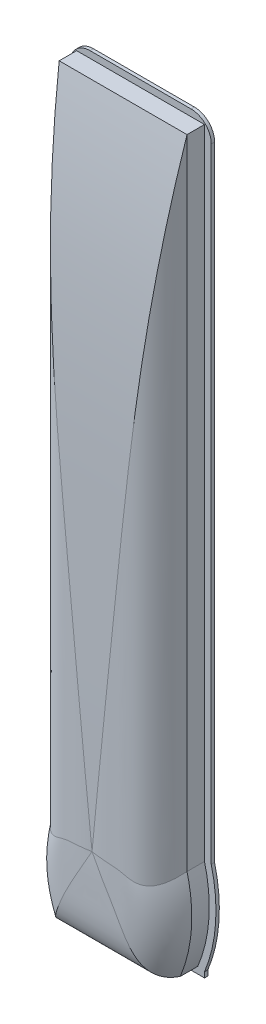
SolidWorks part; units mm, degrees
ref_plane "Ebene vorne" through (0, 0, 0) normal (0, 0, 1) x (1, 0, 0)
ref_plane "Ebene oben" through (0, 0, 0) normal (0, 1, 0) x (1, 0, 0)
ref_plane "Ebene rechts" through (0, 0, 0) normal (1, 0, 0) x (0, 0, -1)
sketch "Oben Master" plane through (0, 0, 0) normal (0, 0, 1) x (1, 0, 0)
  line L0 (0, 0) -> (0, 113.819) construction
  line L1 (7.4998, 109.3467) -> (-7.4998, 109.3467)
  line L2 (-9.5, 107.3446) -> (-9.5, 14.4995)
  line L3 (-8.5, 0.4995) -> (-8.5, 0.4995)
  line L4 (-8.5, 0.4995) -> (-3.5, 0.4995)
  line L5 (-3.5, 0.4995) -> (-3.5, 1)
  line L6 (-3.5, 1) -> (3.5, 1)
  line L7 (3.5, 1) -> (3.5, 0.4995)
  line L8 (3.5, 0.4995) -> (8.5, 0.4995)
  line L9 (8.5, 0.4995) -> (8.5, 0.4995)
  line L10 (9.5, 14.4995) -> (9.5, 107.3446)
  line L20 (2.5, 0) -> (2.5, -0.5005)
  line L21 (2.5, -0.5005) -> (9.5, -0.5005)
  line L22 (9.5, -0.5005) -> (9.5, 0.3012)
  line L23 (10.5, 14.6254) -> (10.5, 107.3448)
  line L24 (7.5, 110.3467) -> (-7.5, 110.3467)
  line L25 (-10.5, 107.3448) -> (-10.5, 14.6254)
  line L26 (-9.5, 0.3012) -> (-9.5, -0.5005)
  line L27 (-9.5, -0.5005) -> (-2.5, -0.5005)
  line L28 (-2.5, -0.5005) -> (-2.5, 0)
  line L29 (-2.5, 0) -> (2.5, 0)
  arc A0 (-9.5, 14.4995) -> (-8.5, 0.4995) centre (11.7977, 8.9851) ccw
  arc A1 (8.5, 0.4995) -> (9.5, 14.4995) centre (-11.7977, 8.9851) ccw
  arc A4 (9.5, 0.3012) -> (10.5, 14.6254) centre (-11.7977, 8.9851) ccw
  arc A5 (-10.5, 14.6254) -> (-9.5, 0.3012) centre (11.7977, 8.9851) ccw
  ellipse E1 centre (-9.5, 104.4132) end of major axis (-9.5, 105.4141) minor radius 1 (-10.5, 104.4132) -> (-9.5, 103.4122) ccw
  ellipse E3 centre (-9.5, 104.4132) end of major axis (-9.5, 105.4141) minor radius 1 (-9.5, 105.4141) -> (-10.5, 104.4132) ccw
  ellipse E5 centre (-9.5, 95.3481) end of major axis (-9.5, 96.3491) minor radius 1 (-9.5, 96.3491) -> (-10.5, 95.3481) ccw
  ellipse E7 centre (-9.5, 95.3481) end of major axis (-9.5, 96.3491) minor radius 1 (-10.5, 95.3481) -> (-9.5, 94.3471) ccw
  ellipse E9 centre (-9.5, 88.4775) end of major axis (-9.5, 87.4765) minor radius 1 (-9.5, 89.4785) -> (-10.5, 88.4775) ccw
  ellipse E11 centre (-9.5, 88.4775) end of major axis (-9.5, 87.4765) minor radius 1 (-10.5, 88.4775) -> (-9.5, 87.4765) ccw
  ellipse E13 centre (-9.5, 79.4124) end of major axis (-9.5, 78.4114) minor radius 1 (-9.5, 80.4134) -> (-10.5, 79.4124) ccw
  ellipse E15 centre (-9.5, 79.4124) end of major axis (-9.5, 80.4134) minor radius 1 (-10.5, 79.4124) -> (-9.5, 78.4114) ccw
  ellipse E17 centre (-9.5, 72.5418) end of major axis (-9.5, 71.5408) minor radius 1 (-9.5, 73.5428) -> (-10.5, 72.5418) ccw
  ellipse E19 centre (-9.5, 72.5418) end of major axis (-9.5, 71.5408) minor radius 1 (-10.5, 72.5418) -> (-9.5, 71.5408) ccw
  ellipse E21 centre (-9.5, 63.4767) end of major axis (-9.5, 62.4758) minor radius 1 (-9.5, 64.4777) -> (-10.5, 63.4767) ccw
  ellipse E23 centre (-9.5, 63.4767) end of major axis (-9.5, 64.4777) minor radius 1 (-10.5, 63.4767) -> (-9.5, 62.4758) ccw
  ellipse E25 centre (-9.5, 56.6061) end of major axis (-9.5, 55.6051) minor radius 1 (-9.5, 57.6071) -> (-10.5, 56.6061) ccw
  ellipse E27 centre (-9.5, 56.6061) end of major axis (-9.5, 57.6071) minor radius 1 (-10.5, 56.6061) -> (-9.5, 55.6051) ccw
  ellipse E29 centre (-9.5, 47.5411) end of major axis (-9.5, 46.5401) minor radius 1 (-9.5, 48.542) -> (-10.5, 47.5411) ccw
  ellipse E31 centre (-9.5, 47.5411) end of major axis (-9.5, 48.542) minor radius 1 (-10.5, 47.5411) -> (-9.5, 46.5401) ccw
  ellipse E33 centre (-9.5, 40.6705) end of major axis (-9.5, 39.6695) minor radius 1 (-9.5, 41.6714) -> (-10.5, 40.6705) ccw
  ellipse E35 centre (-9.5, 40.6705) end of major axis (-9.5, 39.6695) minor radius 1 (-10.5, 40.6705) -> (-9.5, 39.6695) ccw
  ellipse E37 centre (-9.5, 31.6054) end of major axis (-9.5, 32.6064) minor radius 1 (-10.5, 31.6054) -> (-9.5, 30.6044) ccw
  ellipse E39 centre (-9.5, 31.6054) end of major axis (-9.5, 30.6044) minor radius 1 (-9.5, 32.6064) -> (-10.5, 31.6054) ccw
  ellipse E41 centre (-9.5, 24.7348) end of major axis (-9.5, 25.7358) minor radius 1 (-9.5, 25.7358) -> (-10.5, 24.7348) ccw
  ellipse E43 centre (-9.5, 24.7348) end of major axis (-9.5, 25.7358) minor radius 1 (-10.5, 24.7348) -> (-9.5, 23.7338) ccw
  ellipse E45 centre (-9.5, 15.6697) end of major axis (-9.5, 16.6707) minor radius 1 (-9.5, 16.6707) -> (-10.5, 15.6697) ccw
  ellipse E47 centre (-9.5, 15.6697) end of major axis (-9.5, 16.6707) minor radius 1 (-10.5, 15.6697) -> (-9.5, 14.6687) ccw
  ellipse E49 centre (-10.1882, 9.8177) end of major axis (-10.1882, 10.8187) minor radius 1 (-10.1295, 10.817) -> (-11.1875, 9.8537) ccw
  ellipse E51 centre (-10.1882, 9.8177) end of major axis (-9.1882, 9.8177) minor radius 0.999 (-11.1882, 9.8177) -> (-10.2013, 8.8188) ccw
  ellipse E53 centre (-9.7425, 4.5537) end of major axis (-9.7425, 3.5528) minor radius 1 (-9.9237, 5.5382) -> (-10.7425, 4.5537) ccw
  ellipse E55 centre (-9.7425, 4.5537) end of major axis (-8.7425, 4.5537) minor radius 0.999 (-10.7425, 4.5537) -> (-9.5167, 3.5805) ccw
  ellipse E57 centre (-5.6, 109.39) end of major axis (-5.6, 108.3891) minor radius 1 (-5.6443, 110.39) -> (-6.6, 109.39) ccw
  ellipse E59 centre (-5.6, 109.39) end of major axis (-5.6, 108.3891) minor radius 1 (-4.6, 109.39) -> (-5.5557, 110.39) ccw
  ellipse E61 centre (0, 109.39) end of major axis (0, 108.3891) minor radius 1 (-0.0443, 110.39) -> (-1, 109.39) ccw
  ellipse E63 centre (0, 109.39) end of major axis (0, 108.3891) minor radius 1 (1, 109.39) -> (0.0443, 110.39) ccw
  ellipse E65 centre (5.6, 109.39) end of major axis (5.6, 110.391) minor radius 1 (6.6, 109.39) -> (5.6443, 110.39) ccw
  ellipse E67 centre (5.6, 109.39) end of major axis (5.6, 110.391) minor radius 1 (5.5557, 110.39) -> (4.6, 109.39) ccw
  spline S0 degree 1 poles (-7.4998, 109.3467) (-9.5, 107.3446) knots 0 0 1 1 construction
  spline S1 degree 1 poles (9.5, 107.3446) (7.4998, 109.3467) knots 0 0 1 1 construction
  spline S2 degree 3 poles (-7.4998, 109.3467) (-8.01, 109.3465) (-9.0728, 108.9205) (-9.4998, 107.8555) (-9.5, 107.3446) knots 0.00005 0.00005 0.00005 0.00005 0.5 0.999949 0.999949 0.999949 0.999949
  spline S3 degree 3 poles (9.5, 107.3446) (9.4998, 107.8551) (9.0741, 108.9192) (8.0103, 109.3465) (7.4998, 109.3467) knots 0.00005 0.00005 0.00005 0.00005 0.499999 0.999949 0.999949 0.999949 0.999949
  spline S5 degree 2 poles (10.5, 107.3448) (10.4998, 107.9419) (10.2718, 108.4932) (10.044, 109.0439) (9.6224, 109.4664) (9.2017, 109.888) (8.6508, 110.1171) (8.0991, 110.3465) (7.5, 110.3467) knots 0 0 0 0.25 0.25 0.5 0.5 0.75 0.75 1 1 1
  spline S6 degree 2 poles (-7.5, 110.3467) (-8.0971, 110.3465) (-8.6484, 110.1181) (-9.1987, 109.89) (-9.6209, 109.4679) (-10.042, 109.0468) (-10.2708, 108.4957) (-10.4998, 107.9439) (-10.5, 107.3448) knots 0 0 0 0.25 0.25 0.5 0.5 0.75 0.75 1 1 1
  dimension "D1" = 1
ref_plane "Hinten" through (0, 110.3467, 0) normal (0, 1, 0) x (-1, 0, 0)
ref_plane "Vorn" through (0, -0.5005, 0) normal (0, 1, 0) x (-1, 0, 0)
ref_plane "Ebene3" through (0, 109.3467, 0) normal (0, 1, 0) x (-1, 0, 0)
sketch "Hinten eckig" plane through (0, 110.3467, 0) normal (0, 1, 0) x (-1, 0, 0)
  line B0 (3.9658, 9.3399) -> (4.2597, 9.5705)
  line B1 (4.1712, 9.1409) -> (3.9658, 9.3399)
  line B2 (-0.8535, 3.2331) -> (-0.835, 0.4969)
  line B3 (0.7828, 0.5219) -> (0.7642, 3.2582)
  line B4 (0.7951, -1.8098) -> (0.7828, 0.5219)
  line B5 (5.9708, 0.4833) -> (5.9523, 3.2195)
  line B6 (4.3878, 0.5182) -> (0.7828, 0.5219)
  line B7 (0.7795, -0.0373) -> (4.3846, -0.0409)
  line B8 (-0.835, 0.4969) -> (-4.44, 0.5006)
  line B9 (-4.4086, 0.0014) -> (-0.8034, -0.0023)
  line B10 (-3.9584, 9.3601) -> (-4.2239, 9.5939)
  line B11 (-9.3309, 1.3292) -> (-9.3343, 0.7699)
  line B12 (-4.1575, 9.1548) -> (-3.9584, 9.3601)
  line B13 (-6.023, 0.5356) -> (-8.0452, 0.5043)
  line B14 (0.0262, 12.5033) -> (-1.2819, 12.4592)
  line B15 (-1.2819, 12.4592) -> (-2.6595, 12.2951)
  line B16 (4.0007, 9.3998) -> (3.691, 9.419)
  line B17 (0.149, 9.9471) -> (-0.1006, 9.9314)
  line B18 (-1.753, 9.8463) -> (-2.0974, 9.8053)
  line B19 (-3.6741, 9.4359) -> (-3.9584, 9.3601)
  line B20 (-8.9516, 2.9531) -> (-9.1696, 2.4381)
  line B21 (-9.1696, 2.4381) -> (-9.2676, 1.8537)
  line B22 (-9.0369, 3.0826) -> (-9.255, 2.5678)
  line B23 (-9.255, 2.5678) -> (-9.413, 2.0179)
  line B24 (-8.7523, 4.6814) -> (-9.3085, 3.721)
  line B25 (-8.7933, 5.0258) -> (-9.3148, 4.1254)
  line B26 (-8.7395, 5.3955) -> (-9.2958, 4.435)
  line B27 (10.7962, 4.6627) -> (11.1754, 4.7637)
  line B28 (-10.4073, 0) -> (10.4073, 0)
sketch_block_instance "Block4-1"
sketch_block "Block4"
sketch "Vorn rund" plane through (0, -0.5005, 0) normal (0, 1, 0) x (-1, 0, 0)
  line L0 (2.5, 0) -> (-2.5, 0) construction
  line L1 (2.5, 0) -> (-2.5, 0)
  line L2 (0, 0) -> (0, -4.3632) construction
  line B0 (-11.3923, 1.0416) -> (-11.3496, 0.1382)
  line B1 (-10.6355, 0.1293) -> (-10.6008, 0.7487)
  line B2 (8.4284, -5.6606) -> (-8.4783, -5.7396)
  line B3 (-3.0393, -2.3777) -> (-3.0296, 0.0141)
  line B4 (7.4782, 5.6712) -> (5.4825, 6.6529)
  line B5 (5.4825, 6.6529) -> (4.476, 6.9889)
  line B6 (1.0949, 7.6442) -> (-0.0494, 7.7393)
  line B7 (-0.0494, 7.7393) -> (-1.297, 7.6537)
  line B8 (-1.297, 7.6537) -> (-2.6737, 7.4823)
  line B9 (-7.8197, 5.4712) -> (-8.405, 5.0068)
  line B10 (-8.405, 5.0068) -> (-8.8956, 4.5682)
  line B11 (-9.4207, 4.0694) -> (-9.7909, 3.5619)
  line B12 (-7.0407, -3.9247) -> (-6.3008, -4.0283)
  line B13 (-6.3008, -4.0283) -> (-5.8878, -3.865)
  line B14 (-6.5833, -0.7501) -> (-7.0566, -0.8789)
  line B15 (-10.9797, 0.0864) -> (-11.0744, 0.0606)
  line B16 (-11.0744, 0.0606) -> (-11.1345, 0.095)
  line B17 (-11.1345, 0.095) -> (-11.2292, 0.0693)
  line B18 (-11.2292, 0.0693) -> (-11.3496, 0.1382)
  line B19 (-9.9645, -0.0947) -> (-10.6529, -0.1805)
  line B20 (-10.9626, -0.1631) -> (-11.3154, -0.3608)
sketch_block_instance "Block5-1"
sketch_block "Block5"
sketch "Skizze7" plane through (0, 0, 0) normal (0, 0, 1) x (1, 0, 0)
  line L0 (11.7977, 8.9851) -> (-11.7977, 8.9851) construction
  line L10 (-2.5, -0.5005) -> (-2.5, 0)
  line L11 (-9.5, -0.5005) -> (-2.5, -0.5005)
  line L12 (-9.5, 0.3012) -> (-9.5, -0.5005)
  line L13 (-10.5, 107.3448) -> (-10.5, 14.6254)
  line L14 (7.5, 110.3467) -> (-7.5, 110.3467)
  line L15 (10.5, 14.6254) -> (10.5, 107.3448)
  line L16 (9.5, -0.5005) -> (9.5, 0.3012)
  line L17 (2.5, -0.5005) -> (9.5, -0.5005)
  line L18 (2.5, 0) -> (2.5, -0.5005)
  line L19 (-2.5, 0) -> (2.5, 0)
  line L20 (-2.5, -0.5005) -> (-2.5, 0)
  line L21 (-9.5, -0.5005) -> (-2.5, -0.5005)
  line L22 (-9.5, 0.3012) -> (-9.5, -0.5005)
  line L23 (-10.5, 107.3448) -> (-10.5, 14.6254)
  line L24 (7.5, 110.3467) -> (-7.5, 110.3467)
  line L25 (10.5, 14.6254) -> (10.5, 107.3448)
  line L26 (9.5, -0.5005) -> (9.5, 0.3012)
  line L27 (2.5, -0.5005) -> (9.5, -0.5005)
  line L28 (2.5, 0) -> (2.5, -0.5005)
  line L29 (-2.5, 0) -> (2.5, 0)
  arc A2 (-10.5, 14.6254) -> (-9.5, 0.3012) centre (11.7977, 8.9851) ccw
  arc A3 (9.5, 0.3012) -> (10.5, 14.6254) centre (-11.7977, 8.9851) ccw
  arc A4 (-10.5, 14.6254) -> (-9.5, 0.3012) centre (11.7977, 8.9851) ccw
  arc A5 (9.5, 0.3012) -> (10.5, 14.6254) centre (-11.7977, 8.9851) ccw
  spline S2 degree 2 poles (713.2699, -2800.8964) (54.1611, 136.1464) (-8.6484, 110.1181) (-9.1987, 109.89) (-9.6209, 109.4679) (-10.042, 109.0468) (-10.2708, 108.4957) (-36.3165, 45.7429) (2896.8308, -629.2597) knots -28.236731 -28.236731 -28.236731 0.25 0.25 0.5 0.5 0.75 0.75 29.181014 29.181014 29.181014 only from (-7.5, 110.3467) to (-10.5, 107.3448)
  spline S3 degree 2 poles (-2900.6155, -613.9447) (36.2756, 45.6192) (10.2718, 108.4932) (10.044, 109.0439) (9.6224, 109.4664) (9.2017, 109.888) (8.6508, 110.1171) (-54.0371, 136.1872) (-728.5512, -2797.0685) knots -28.261947 -28.261947 -28.261947 0.25 0.25 0.5 0.5 0.75 0.75 29.155742 29.155742 29.155742 only from (10.5, 107.3448) to (7.5, 110.3467)
  spline S4 degree 2 poles (-7.5, 110.3467) (-8.0971, 110.3465) (-8.6484, 110.1181) (-9.1987, 109.89) (-9.6209, 109.4679) (-10.042, 109.0468) (-10.2708, 108.4957) (-10.4998, 107.9439) (-10.5, 107.3448) knots 0 0 0 0.25 0.25 0.5 0.5 0.75 0.75 1 1 1
  spline S5 degree 2 poles (10.5, 107.3448) (10.4998, 107.9419) (10.2718, 108.4932) (10.044, 109.0439) (9.6224, 109.4664) (9.2017, 109.888) (8.6508, 110.1171) (8.0991, 110.3465) (7.5, 110.3467) knots 0 0 0 0.25 0.25 0.5 0.5 0.75 0.75 1 1 1
  dimension "D1" = 0
extrude "Linear austragen1" add sketch "Skizze7" along normal blind 0.5
sketch "Skizze20" plane through (0, 0, 0.5) normal (0, 0, 1) x (1, 0, 0)
  line L20 (-8.5, 0.4995) -> (-3.5, 0.4995)
  line L21 (-3.5, 0.4995) -> (-3.5, 1)
  line L22 (-3.5, 1) -> (3.5, 1)
  line L23 (3.5, 1) -> (3.5, 0.4995)
  line L24 (3.5, 0.4995) -> (8.5, 0.4995)
  line L25 (9.5, 14.4995) -> (9.5, 107.3444)
  line L26 (7.5, 109.3467) -> (-7.4996, 109.3467)
  line L27 (-9.5, 107.3448) -> (-9.5, 14.4995)
  line L28 (-8.5, 0.4995) -> (8.5, 0.4995)
  line L33 (9.5, 14.4995) -> (9.5, 109.3467)
  line L34 (9.5, 109.3467) -> (-9.5, 109.3467)
  line L35 (-9.5, 109.3467) -> (-9.5, 14.4995)
  arc A4 (8.5, 0.4995) -> (9.5, 14.4995) centre (-11.7977, 8.9851) ccw
  arc A5 (-9.5, 14.4995) -> (-8.5, 0.4995) centre (11.7977, 8.9851) ccw
  arc A6 (8.5, 0.4995) -> (9.5, 14.4995) centre (-11.7977, 8.9851) ccw
  arc A7 (-9.5, 14.4995) -> (-8.5, 0.4995) centre (11.7977, 8.9851) ccw
  spline S4 degree 3 poles (3964.4855, 699.077) (-562.275, -46.0003) (14.8299, 80.6068) (9.4371, 107.8617) (9.3983, 107.9884) (9.2983, 108.2308) (9.2375, 108.346) (9.0928, 108.5635) (9.008, 108.6662) (8.8237, 108.8513) (8.7234, 108.9347) (8.5051, 109.0812) (8.3882, 109.1432) (-5.6702, 114.9984) (-93.3907, -37.5243) (3687.0661, -1447.9628) knots -26.430749 -26.430749 -26.430749 -26.430749 0.125 0.125 0.25 0.25 0.375 0.375 0.5 0.5 0.625 0.625 0.75 0.75 15.225421 15.225421 15.225421 15.225421 only from (9.5, 107.3444) to (7.5, 109.3467)
  spline S5 degree 3 poles (-599.4917, 4064.2795) (145.9772, -463.2528) (19.2162, 114.6882) (-8.0169, 109.2836) (-8.1436, 109.2447) (-8.3858, 109.1445) (-8.501, 109.0836) (-8.7183, 108.9385) (-8.8209, 108.8536) (-9.0057, 108.669) (-9.0889, 108.5686) (-9.2352, 108.35) (-9.297, 108.2332) (-15.1452, 94.1505) (137.5454, 6.4943) (1533.7503, 3792.9331) knots -26.411857 -26.411857 -26.411857 -26.411857 0.125 0.125 0.25 0.25 0.375 0.375 0.5 0.5 0.625 0.625 0.75 0.75 15.244525 15.244525 15.244525 15.244525 only from (-7.4996, 109.3467) to (-9.5, 107.3448)
  spline S6 degree 3 poles (9.5, 107.3444) (9.5, 107.4764) (9.4876, 107.6063) (9.4371, 107.8617) (9.3983, 107.9884) (9.2983, 108.2308) (9.2375, 108.346) (9.0928, 108.5635) (9.008, 108.6662) (8.8237, 108.8513) (8.7234, 108.9347) (8.5051, 109.0812) (8.3882, 109.1432) (8.0272, 109.2936) (7.7644, 109.3466) (7.5, 109.3467) knots 0 0 0 0 0.125 0.125 0.25 0.25 0.375 0.375 0.5 0.5 0.625 0.625 0.75 0.75 1 1 1 1 construction
  spline S7 degree 3 poles (-7.4996, 109.3467) (-7.6316, 109.3467) (-7.7615, 109.3343) (-8.0169, 109.2836) (-8.1436, 109.2447) (-8.3858, 109.1445) (-8.501, 109.0836) (-8.7183, 108.9385) (-8.8209, 108.8536) (-9.0057, 108.669) (-9.0889, 108.5686) (-9.2352, 108.35) (-9.297, 108.2332) (-9.447, 107.8719) (-9.4999, 107.6092) (-9.5, 107.3448) knots 0 0 0 0 0.125 0.125 0.25 0.25 0.375 0.375 0.5 0.5 0.625 0.625 0.75 0.75 1 1 1 1 construction
  dimension "D1" = 1
extrude "Linear austragen7" add sketch "Skizze20" along normal blind 2.6
sketch "Skizze6" plane through (0, -0.5005, 0) normal (0, 1, 0) x (-1, 0, 0)
  line L0 (0, -6.8266) -> (0, 9.0288) construction
  line L1 (-0.0494, 7.7393) -> (-7.8197, 5.4712) construction
  line L2 (-3.9345, 6.6052) -> (-0.0138, -6.8266) construction
  line L3 (-2.5892, 1.9964) -> (-2.6957, 2.3611) construction
  line L4 (0.5228, 7.6917) -> (6.7967, 6.0065) construction
  line L5 (1.0949, 7.6442) -> (-0.0494, 7.7393) construction
  line L6 (7.4782, 5.6712) -> (5.4825, 6.6529) construction
  line L7 (3.6597, 6.8491) -> (-0.0138, -6.8266) construction
  line L8 (-1.4467, -8.0426) -> (2.1223, -8.0426) construction
  line L9 (-0.0138, -6.8266) -> (0.0485, -6.8266) construction
  line L10 (-10.6252, 0.3118) -> (-9.7909, 3.5619) construction
  line L11 (-10.6355, 0.1293) -> (-10.6008, 0.7487) construction
  line L12 (-9.7909, 3.5619) -> (-10.208, 1.9368) construction
  line L13 (-10.208, 1.9368) -> (-1.9532, -0.1823) construction
  line L14 (-9.7909, 3.5619) -> (-8.405, 5.0068) construction
  line L15 (-9.0979, 4.2844) -> (-5.3503, 0.6897) construction
  line L16 (-8.4323, 5.0196) -> (0, -6.8266) construction
  line L17 (8.4323, 5.0196) -> (0, -6.8266) construction
  line L18 (0, 0) -> (-13.7892, 0) construction
  line L20 (-9.5, 0.5) -> (-11.2023, 0.5) construction
  line L21 (9.0979, 4.2844) -> (5.3503, 0.6897) construction
  line L22 (10.6617, 0.5) -> (-10.6617, 0.5)
  line L23 (9.7909, 3.5619) -> (8.405, 5.0068) construction
  line L24 (9.7909, 3.5619) -> (10.208, 1.9368) construction
  line L25 (10.6252, 0.3118) -> (9.7909, 3.5619) construction
  arc A0 (8.4323, 5.0196) -> (-8.4323, 5.0196) centre (0, -6.8266) ccw
  arc A1 (-8.4323, 5.0196) -> (-10.6617, 0.5) centre (-5.3503, 0.6897) ccw
  arc A2 (8.4323, 5.0196) -> (10.6617, 0.5) centre (5.3503, 0.6897) cw
sketch "Skizze8" plane through (0, 109.3467, 0) normal (0, 1, 0) x (-1, 0, 0)
  line L0 (-3.965, 9.35) -> (3.965, 9.35) construction
  line L1 (9.5, 0.5) -> (9.5, 2.3569)
  line L2 (0, 0) -> (3.965, 9.35) construction
  line L3 (0, 0) -> (0, 15.3071) construction
  line L4 (0, 0) -> (-3.965, 9.35) construction
  line L5 (-4.543, 8.8909) -> (-9.0199, 3.6569)
  line L6 (-9.5, 0.5) -> (-9.5, 2.3569)
  line L8 (-7.5, 0.5) -> (7.5, 0.5) construction
  line L9 (4.543, 8.8909) -> (9.0199, 3.6569)
  line L10 (-10.5, 0.5) -> (-10.5, 0) construction
  line L11 (10.5, 0.5) -> (10.5, 0) construction
  line L12 (-9.5, 0.5) -> (9.5, 0.5)
  arc A0 (-3.5526, 9.5195) -> (3.5526, 9.5195) centre (0, -3.4217) cw
  arc A1 (-3.5526, 9.5195) -> (-4.543, 8.8909) centre (-3.0232, 7.5909) ccw
  arc A2 (4.543, 8.8909) -> (3.5526, 9.5195) centre (3.0232, 7.5909) ccw
  arc A3 (-9.5, 2.3569) -> (-9.0199, 3.6569) centre (-7.5, 2.3569) cw
  arc A4 (9.5, 2.3569) -> (9.0199, 3.6569) centre (7.5, 2.3569) ccw
  dimension "D3" = 1
  dimension "D1" = 2
  dimension "D2" = 9.35
  dimension "D4" = 1
ref_plane "Ebene1" through (0, 8.9851, 0) normal (0, 1, 0) x (-1, 0, 0)
sketch "Skizze10" plane through (0, 8.9851, 0) normal (0, 1, 0) x (-1, 0, 0)
  line L0 (0, 0) -> (0, 9.7413) construction
  line L1 (-10.6617, 0.5) -> (10.6617, 0.5)
  line L2 (8.5, 3.1) -> (-8.5, 3.1) construction
  line L3 (-11.2023, 0.5) -> (-10.2023, 0.5) construction
  line L4 (-7.5, 0.5) -> (-10.5, 0.5) construction
  line L5 (10.2023, 3.1) -> (-10.2023, 3.1)
  line L6 (-8.5, 3.1) -> (-10.2023, 3.1) construction
  arc A0 (-10.2023, 3.1) -> (-8.673, 4.8446) centre (-5.3844, 0.4192) cw
  arc A1 (10.2023, 3.1) -> (8.673, 4.8446) centre (5.3844, 0.4192) ccw
  arc A3 (10.6617, 0.5) -> (8.4323, 5.0196) centre (5.3503, 0.6897) ccw
  arc A4 (8.4323, 5.0196) -> (-8.4323, 5.0196) centre (0, -6.8266) ccw
  arc A5 (-8.4323, 5.0196) -> (-10.6617, 0.5) centre (-5.3503, 0.6897) ccw
  arc A7 (8.673, 4.8446) -> (-8.673, 4.8446) centre (0, -6.8266) ccw
  dimension "D2" = 1
  dimension "D1" = 0
ref_plane "Ebene2" through (0, 14.6254, 0) normal (0, 1, 0) x (-1, 0, 0)
sketch "Formgeber Mitte" plane through (0, 14.6254, 0) normal (0, 1, 0) x (-1, 0, 0)
  line L0 (0, -6.822) -> (0, 15.3071) construction
  line L1 (-9.5, 3.1) -> (9.5, 3.1) construction
  line L5 (-9.5, 3.1) -> (9.5, 3.1)
  line L10 (0, 0) -> (0, -2.1163) construction
  line L11 (-9.5, 3.1) -> (-7.1707, 5.8233)
  line L12 (-4.543, 8.8909) -> (-9.0199, 3.6569) construction
  line L13 (9.5, 3.1) -> (7.1707, 5.8233)
  arc A5 (8.673, 4.8446) -> (-8.673, 4.8446) centre (0, -6.8266) ccw construction
  arc A6 (7.1707, 5.8233) -> (-7.1707, 5.8233) centre (0, -6.8266) ccw
sketch "Formgeber hinten" plane through (0, 109.3467, 0) normal (0, 1, 0) x (1, 0, 0)
  line L0 (4.543, -8.8909) -> (9.0199, -3.6569) construction
  line L1 (4.543, -8.8909) -> (9.4962, -3.1)
  line L2 (-4.543, -8.8909) -> (-9.0199, -3.6569) construction
  line L3 (-4.543, -8.8909) -> (-9.4962, -3.1)
  line L4 (9.5, -3.1) -> (-9.5, -3.1) construction
  line L5 (9.4962, -3.1) -> (-9.4962, -3.1)
  arc A0 (3.5526, -9.5195) -> (4.543, -8.8909) centre (3.0232, -7.5909) ccw construction
  arc A1 (3.5526, -9.5195) -> (4.543, -8.8909) centre (3.0232, -7.5909) ccw
  arc A2 (-3.5526, -9.5195) -> (3.5526, -9.5195) centre (0, 3.4217) ccw construction
  arc A3 (-3.5526, -9.5195) -> (3.5526, -9.5195) centre (0, 3.4217) ccw
  arc A4 (-4.543, -8.8909) -> (-3.5526, -9.5195) centre (-3.0232, -7.5909) ccw construction
  arc A5 (-4.543, -8.8909) -> (-3.5526, -9.5195) centre (-3.0232, -7.5909) ccw
sketch "Rücken" plane through (0, 0, 0) normal (1, 0, 0) x (0, 0, -1)
  line L0 (-9.5195, 109.3467) -> (-9.9983, 109.3467) construction
  line L1 (-9.5195, 109.3467) -> (-9.9983, 109.3467) construction
  line L3 (-3.1, 0.4995) -> (-0.5, 0.4995) construction
  line L4 (-4.8446, 8.9851) -> (-7.7143, 8.9851) construction
  line L5 (-4.8446, 8.9851) -> (-7.7143, 8.9851) construction
  line L6 (-3.1, 0.4995) -> (-0.5, 0.4995) construction
  line L7 (-7.7143, 8.9851) -> (-9.9983, 109.3467)
  spline S0 degree 3 poles (-7.7143, 8.9851) (-7.6435, 5.8735) (-7.8099, 0.9279) (-3.1, 0.4995) knots 0 0 0 0 1 1 1 1
sketch "Pkt vorn" plane through (0, 14.6254, 0) normal (0, 1, 0) x (-1, 0, 0)
  arc A0 (7.1707, 5.8233) -> (-7.1707, 5.8233) centre (0, -6.8266) ccw construction
  arc A1 (7.1707, 5.8233) -> (-7.1707, 5.8233) centre (0, -6.8266) ccw construction
  point P3 (0, 7.7143)
sketch "Pkt hinten" plane through (0, 109.3467, 0) normal (0, 1, 0) x (-1, 0, 0)
  arc A0 (3.5526, 9.5195) -> (-3.5526, 9.5195) centre (0, -3.4217) ccw construction
  arc A1 (3.5526, 9.5195) -> (-3.5526, 9.5195) centre (0, -3.4217) ccw construction
  point P3 (0, 9.9983)
sketch "Leitlinie links" plane through (0, 0, 3.1) normal (0, 0, 1) x (1, 0, 0)
  line L0 (9.5, 14.4995) -> (9.5, 109.3467) construction
  line L1 (9.5, 14.4995) -> (9.5, 109.3467)
  arc A0 (8.5, 0.4995) -> (9.5, 14.4995) centre (-11.7977, 8.9851) ccw construction
  arc A1 (8.5, 0.4995) -> (9.5, 14.4995) centre (-11.7977, 8.9851) ccw
sketch "Leitline rechts" plane through (0, 0, 3.1) normal (0, 0, 1) x (1, 0, 0)
  line L0 (-9.5, 109.3467) -> (-9.5, 14.4995) construction
  line L1 (-9.5, 109.3467) -> (-9.5, 14.4995)
  arc A0 (-9.5, 14.4995) -> (-8.5, 0.4995) centre (11.7977, 8.9851) ccw construction
  arc A1 (-9.5, 14.4995) -> (-8.5, 0.4995) centre (11.7977, 8.9851) ccw
sketch "Gerader Abschluß" plane through (0, 0.4995, 0) normal (0, -1, 0) x (1, 0, 0)
  line L0 (-8.5, 3.1) -> (8.5, 3.1) construction
  line L1 (-8.5, 3.1) -> (8.5, 3.1)
sketch "Skizze31" plane through (0, 0, 3.1) normal (0, 0, 1) x (1, 0, 0)
  line L4 (-8.5, 0.4995) -> (8.5, 0.4995)
  line L5 (-9.5, 109.3467) -> (-9.5, 14.4995)
  line L6 (9.5, 109.3467) -> (-9.5, 109.3467)
  line L7 (9.5, 14.4995) -> (9.5, 109.3467)
  line L8 (-8.5, 0.4995) -> (8.5, 0.4995)
  line L9 (-9.5, 109.3467) -> (-9.5, 14.4995)
  line L10 (9.5, 109.3467) -> (-9.5, 109.3467)
  line L11 (9.5, 14.4995) -> (9.5, 109.3467)
  arc A2 (-9.5, 14.4995) -> (-8.5, 0.4995) centre (11.7977, 8.9851) ccw
  arc A3 (8.5, 0.4995) -> (9.5, 14.4995) centre (-11.7977, 8.9851) ccw
  arc A4 (-9.5, 14.4995) -> (-8.5, 0.4995) centre (11.7977, 8.9851) ccw
  arc A5 (8.5, 0.4995) -> (9.5, 14.4995) centre (-11.7977, 8.9851) ccw
  dimension "D1" = 0
sketch "Skizze32" plane through (0, 0, 0) normal (1, 0, 0) x (0, 0, -1)
  line L0 (-7.7143, 8.9851) -> (-9.9983, 109.3467) construction
  line L1 (-7.8427, 14.6254) -> (-9.9983, 109.3467)
sketch "Skizze33" plane through (0, 0, 0) normal (1, 0, 0) x (0, 0, -1)
  line L0 (-7.7143, 8.9851) -> (-9.9983, 109.3467) construction
  line L1 (-7.7143, 8.9851) -> (-7.8427, 14.6254)
  spline S0 degree 3 poles (-1205.4427, -1592.6647) (1244.5026, 1647.3738) (-1318.4035, -1583.5758) (1365.8305, 1457.6872) knots -6.115897 -6.115897 -6.115897 -6.115897 6.496706 6.496706 6.496706 6.496706 only from (-7.7143, 8.9851) to (-3.1, 0.4995) construction
  spline S1 degree 3 poles (-7.7143, 8.9851) (-7.6435, 5.8735) (-7.8099, 0.9279) (-3.1, 0.4995) knots 0 0 0 0 1 1 1 1
loft "Ausformung5" add profiles "Skizze31", "Pkt vorn"
